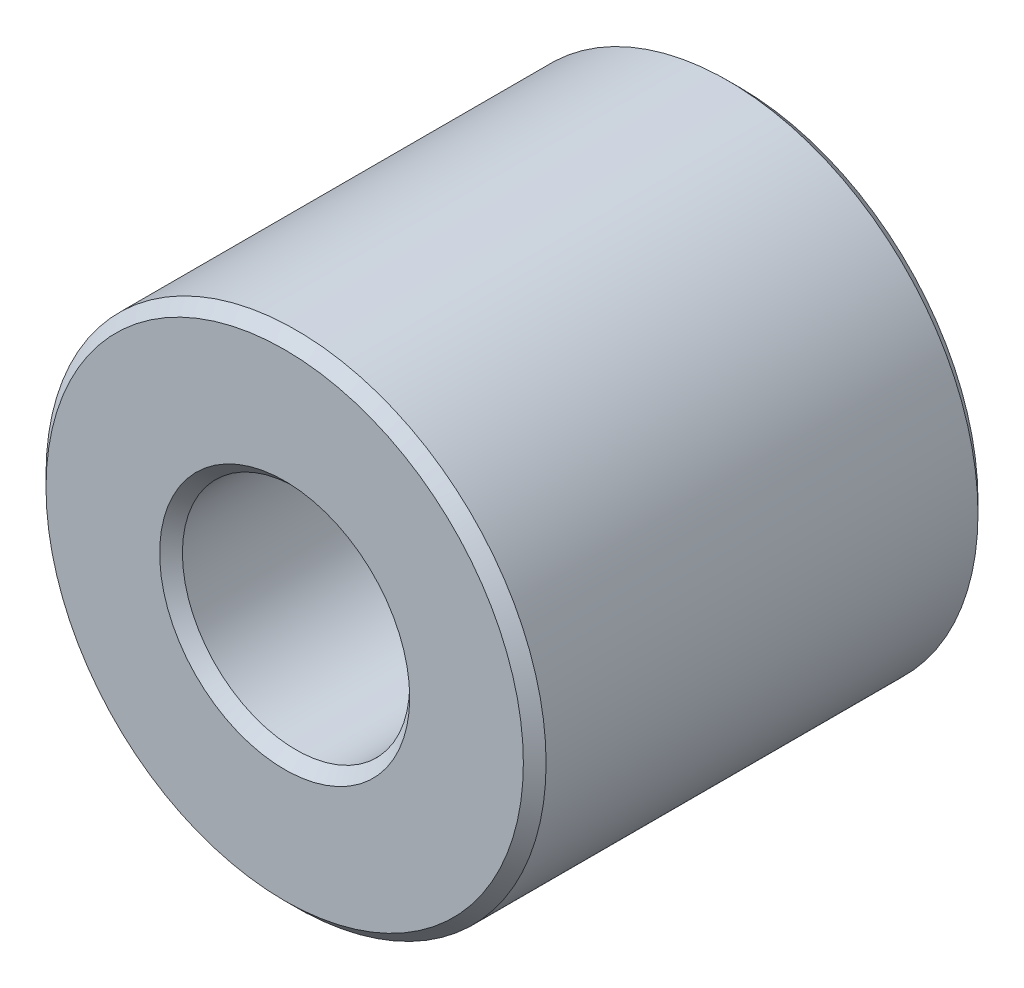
SolidWorks part; units mm, degrees
ref_plane "Front Plane" through (0, 0, 0) normal (0, 0, 1) x (1, 0, 0)
ref_plane "Top Plane" through (0, 0, 0) normal (0, 1, 0) x (1, 0, 0)
ref_plane "Right Plane" through (0, 0, 0) normal (1, 0, 0) x (0, 0, -1)
sketch "Sketch1" plane through (0, 0, 0) normal (0, 0, 1) x (1, 0, 0)
  circle A0 centre (0, 0) radius 5
  circle A1 centre (0, 0) radius 11
  dimension "D1" = 10
  dimension "D2" = 22
extrude "Boss-Extrude1" add sketch "Sketch1" along normal mid plane 20
chamfer "Chamfer1" distance 0.5 angle 45 4 edges at (5, 0, -10) (11, 0, -10) (5, 0, 10) (11, 0, 10)
